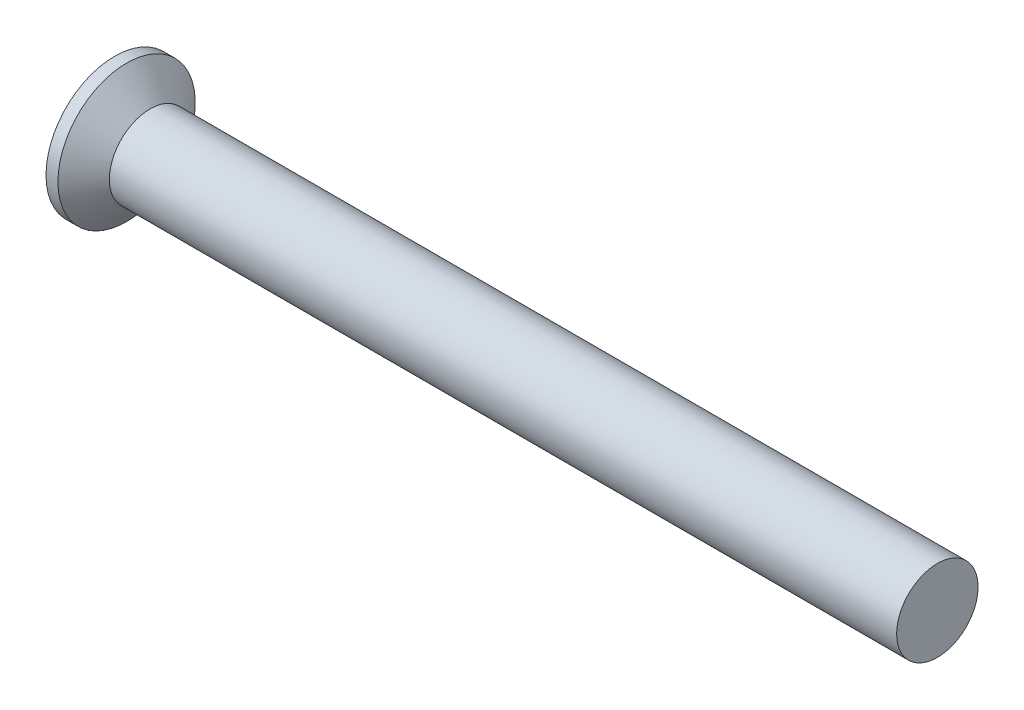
SolidWorks part; units mm, degrees
ref_plane "Plane1" through (0, 0, 0) normal (0, 0, 1) x (1, 0, 0)
ref_plane "Plane2" through (0, 0, 0) normal (0, 1, 0) x (1, 0, 0)
ref_plane "Plane3" through (0, 0, 0) normal (1, 0, 0) x (0, 0, -1)
revolve "Base-Revolve" add sketch "BodySke" angle 360 about L5
sketch "BodySke" plane through (0, 0, 0) normal (0, 0, 1) x (1, 0, 0)
  line L0 (0, 0) -> (0, 2.1209)
  line L1 (0, 2.1209) -> (0.3676, 2.1209)
  line L2 (1.0922, 1.2573) -> (25.4, 1.2573)
  line L3 (25.4, 1.2573) -> (25.4, 0)
  line L4 (25.4, 0) -> (0, 0)
  line L5 (-6.35, 0) -> (82.55, 0) construction
  line L6 (1.0922, -1.2573) -> (25.4, -1.2573) construction
  line L7 (0.3676, -2.1209) -> (1.0922, -1.2573) construction
  line L8 (0.3676, 2.1209) -> (1.0922, 1.2573)
  line L9 (0, -2.1209) -> (0.3676, -2.1209) construction
  line L10 (1.5469, 2.8448) -> (1.5469, -6.6802) construction
  line L11 (0, 6.35) -> (0, -3.175) construction
  dimension "Diameter" = 2.5146
  dimension "Length" = 25.4
  dimension "Head_ht" = 1.0922
  dimension "Head_dia" = 4.2418
  dimension "Head_ang" = 100
  dimension "D6" = 0.3676
  dimension "Advance" = 0.4547
  dimension "Thread_nom" = 25.4
extrude "Slot" cut sketch "Sketch2" against normal blind 0.5588
sketch "Sketch2" plane through (0, 0, 0) normal (-1, 0, 0) x (0, 0, 1)
  line L0 (-2.1209, -0.4445) -> (2.1209, -0.4445)
  line L1 (-2.1209, -0.4445) -> (-2.1209, 0.4445)
  line L2 (2.1209, 0.4445) -> (-2.1209, 0.4445)
  line L3 (2.1209, 0.4445) -> (2.1209, -0.4445)
  dimension "D1" = 0.4445
  dimension "Slot_width" = 0.889
  dimension "D2" = 4.2418
  dimension "D3" = 2.1209
sketch "Sketch3" plane through (0, 0, 0) normal (-1, 0, 0) x (0, 0, 1)
  line L0 (-0.3429, 1.4986) -> (0.3429, 1.4986)
  line L1 (0.3429, 1.4986) -> (0.3429, -1.4986)
  line L2 (0.3429, -1.4986) -> (-0.3429, -1.4986)
  line L3 (-0.3429, -1.4986) -> (-0.3429, 1.4986)
  dimension "D1" = 1.4986
  dimension "Cross_dia" = 2.9972
  dimension "D2" = 0.3429
  dimension "Cross_width" = 0.6858
ref_plane "Plane4" through (1.9558, 0, 0) normal (-1, 0, 0) x (0, 0, 1)
sketch "Sketch4" plane through (1.9558, 0, 0) normal (-1, 0, 0) x (0, 0, 1)
  line L0 (-0.1714, 0.1714) -> (0.1715, 0.1714)
  line L3 (0.1715, 0.1714) -> (0.1715, -0.1715)
  line L4 (0.1715, -0.1715) -> (-0.1714, -0.1715)
  line L5 (-0.1714, -0.1715) -> (-0.1714, 0.1714)
  dimension "D1" = 0.3429
  dimension "D2" = 0.3429
  dimension "D3" = 0.1714
  dimension "D4" = 0.1714
loft "Cross" cut profiles "Sketch3", "Sketch4"
pattern_circular "CirPattern1" count 2 every 90 about axis through (0, 0, 0) along (1, 0, 0) of "Cross"
sketch "ThdSchSke" plane through (0, 0, 0) normal (0, 0, 1) x (1, 0, 0)
  line L0 (1.5469, -0.9881) -> (1.3584, -1.2573)
  line L1 (1.5469, -0.9881) -> (1.7354, -1.2573)
  line L2 (1.7354, -1.2573) -> (1.7354, -1.5716)
  line L3 (-3.175, 0) -> (5.1513, 0) construction
  line L5 (1.7354, -1.5716) -> (1.3584, -1.5716)
  line L6 (1.3584, -1.5716) -> (1.3584, -1.2573)
  line L7 (0, 2.1209) -> (0, -2.1209) construction
  dimension "Thread_minor" = 1.9761
  dimension "Diameter" = 2.5146
  dimension "Start" = 1.5469
  dimension "SideAngle" = 55
  dimension "VeeAngle" = 70
  dimension "Overcut" = 3.1432
revolve "ThreadSchematic" [suppressed] cut sketch "ThdSchSke" angle 360 about L3
pattern_linear "ThdSchPat" [suppressed]
equation "\"D1@Sketch3\" = \"Cross_dia@Sketch3\" / 2"
equation "\"D2@Sketch3\" = \"Cross_width@Sketch3\" / 2"
equation "\"D1@Sketch4\" = \"Cross_width@Sketch3\" *.5"
equation "\"D2@Sketch4\" = \"D1@Sketch4\""
equation "\"D4@Sketch4\" = \"D2@Sketch4\" / 2"
equation "\"D3@Sketch4\" = \"D1@Sketch4\" / 2"
equation "\"D1@Sketch2\" = \"Slot_width@Sketch2\" / 2"
equation "\"D2@Sketch2\" = \"Head_dia@BodySke\""
equation "\"D3@Sketch2\" = \"D2@Sketch2\" / 2"
equation "\"Thread_length@ThreadCosmetic\" = ((sgn( (\"Length@BodySke\" - \"Advance@BodySke\" - \"Head_ht@BodySke\" ) - \"Thread_nom@BodySke\" )-1)*( (\"Length@BodySke\" - \"Advance@BodySke\" - \"Head_ht@BodySke\" ) - \"Thread_"
equation "\"Thread_minor@ThdSchSke\" = \"Thread_minor@ThreadCosmetic\""
equation "\"Diameter@ThdSchSke\" = \"Diameter@BodySke\""
equation "\"Overcut@ThdSchSke\" = \"Diameter@BodySke\" * 1.25"
equation "\"Start@ThdSchSke\" = 0.000001 + \"Length@BodySke\" - \"Thread_length@ThreadCosmetic\"  '---Countersunk---"
equation "\"Num_threads@ThdSchPat\" = int( \"Thread_length@ThreadCosmetic\" / \"Advance@BodySke\" + 0.999 )  + 1"
equation "\"Advance@ThdSchPat\" = \"Thread_length@ThreadCosmetic\" /  (\"Num_threads@ThdSchPat\" - 1) 'relax it"
